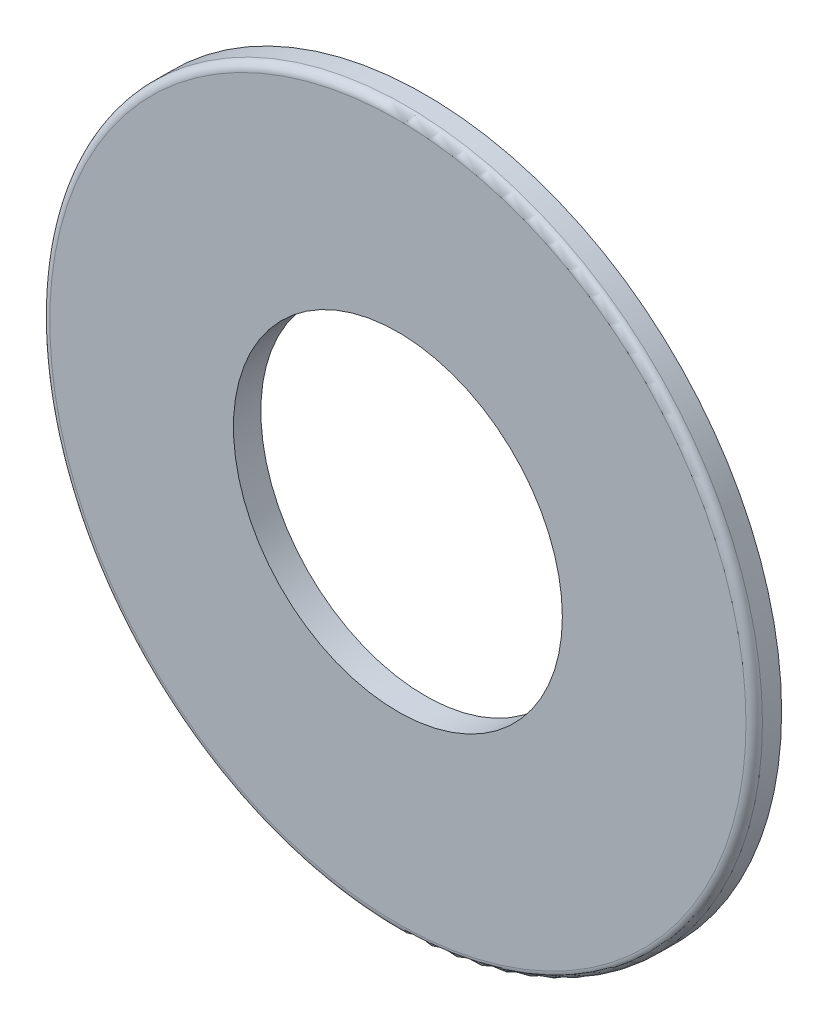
SolidWorks part; units mm, degrees
ref_plane "Face" through (0, 0, 0) normal (0, 0, 1) x (1, 0, 0)
ref_plane "Dessus" through (0, 0, 0) normal (0, 1, 0) x (1, 0, 0)
ref_plane "Droite" through (0, 0, 0) normal (1, 0, 0) x (0, 0, -1)
sketch "Esquisse1" plane through (0, 0, 0) normal (0, 0, 1) x (1, 0, 0)
  circle A0 centre (82.8788, 208.8307) radius 13
  circle A1 centre (82.8788, 208.8307) radius 6
  circle A2 centre (82.8788, 208.8307) radius 6 construction
  dimension "D1" = 12
  dimension "D2" = 26
extrude "Extrusion1" add sketch "Esquisse1" along normal blind 1
fillet "Congé1" radius 0.3 1 edges at (95.8788, 208.8307, 1)
other "Bloquer***"
